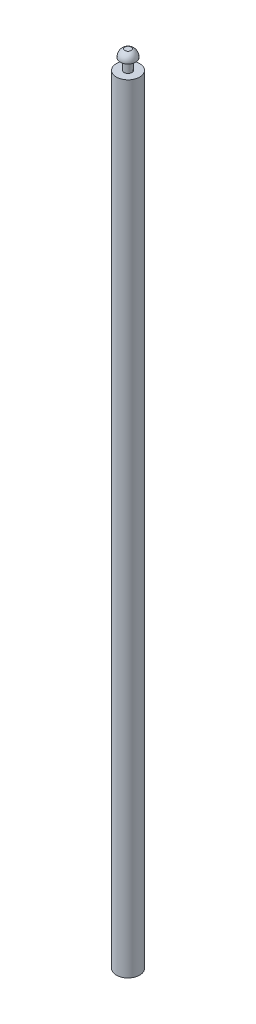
SolidWorks part; units mm, degrees
ref_plane "前视基准面" through (0, 0, 0) normal (0, 0, 1) x (1, 0, 0)
ref_plane "上视基准面" through (0, 0, 0) normal (0, 1, 0) x (1, 0, 0)
ref_plane "右视基准面" through (0, 0, 0) normal (1, 0, 0) x (0, 0, -1)
sketch "草图3" plane through (0, 0, 0) normal (0, 0, 1) x (1, 0, 0)
  line L0 (0, 0) -> (0, 36.3073) construction
  line L1 (-0.25, 35.8073) -> (-0.5, 35.8073)
  line L2 (-0.2, 36.3073) -> (0, 36.3073)
  line L3 (-0.25, 35.8073) -> (-0.25, 35.1073)
  line L4 (-0.25, 35.1073) -> (0, 35.1073)
  line L5 (0, 36.3073) -> (0, 35.1073)
  arc A0 (-0.5, 35.8073) -> (-0.2, 36.3073) centre (0, 35.8473) cw
  dimension "D1" = 0.5
  dimension "D2" = 1
  dimension "D3" = 0.5
  dimension "D4" = 0.7
  dimension "D5" = 0.2
revolve "旋转1" add sketch "草图3" angle 360 about L0
sketch "草图4" plane through (0, 35.1073, 0) normal (0, -1, 0) x (1, 0, 0)
  circle A0 centre (0, 0) radius 0.75
  dimension "D1" = 1.5
extrude "凸台-拉伸1" add sketch "草图4" along normal blind 50
